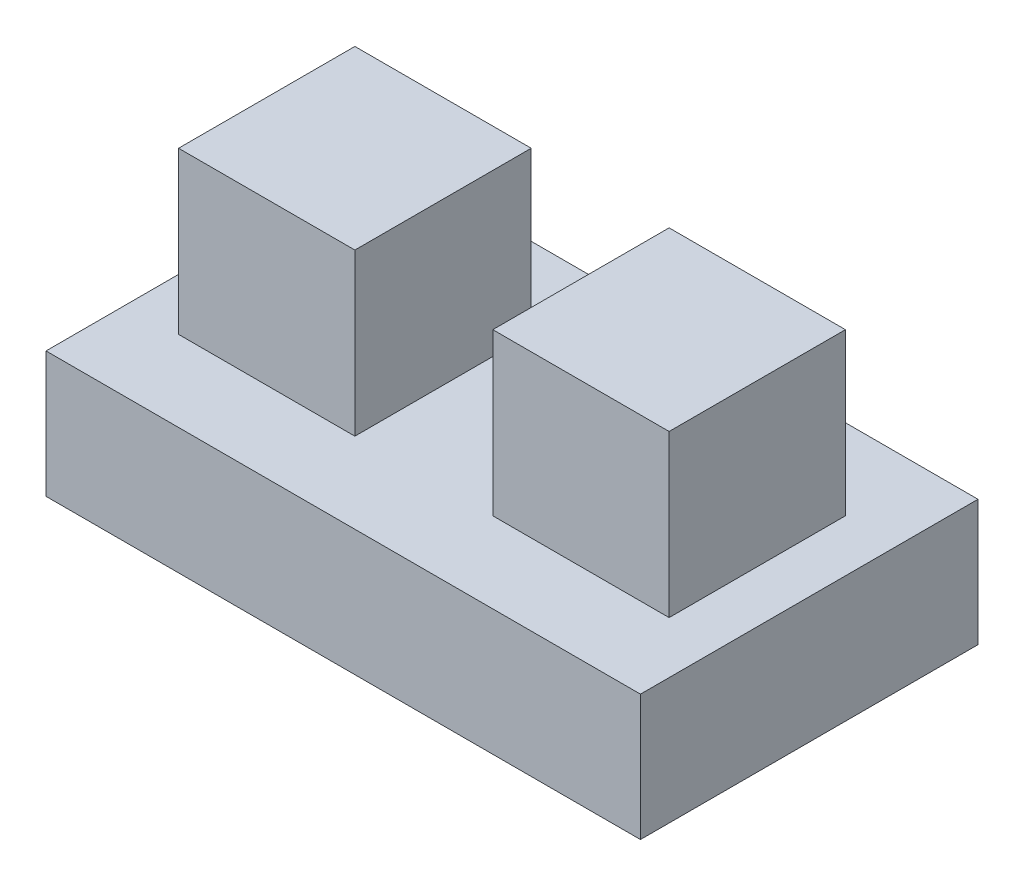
SolidWorks part; units mm, degrees
ref_plane "Ebene vorne" through (0, 0, 0) normal (0, 0, 1) x (1, 0, 0)
ref_plane "Ebene oben" through (0, 0, 0) normal (0, 1, 0) x (1, 0, 0)
ref_plane "Ebene rechts" through (0, 0, 0) normal (1, 0, 0) x (0, 0, -1)
sketch "Skizze1" plane through (0, 0, 0) normal (0, 1, 0) x (1, 0, 0)
  line L0 (-84.5642, 0) -> (115.4627, 0) construction
  line L1 (-59, 33.5) -> (59, 33.5)
  line L2 (-59, 33.5) -> (-59, -33.5)
  line L3 (-59, -33.5) -> (59, -33.5)
  line L4 (59, 33.5) -> (59, -33.5)
  line L5 (0, 70.2533) -> (0, -76.1078) construction
  dimension "D1" = 67
  dimension "D2" = 118
extrude "Aufsatz-Linear austragen1" add sketch "Skizze1" along normal blind 25
sketch "Skizze2" plane through (0, 25, 0) normal (0, 1, 0) x (1, 0, 0)
  line L0 (0, 38.1563) -> (0, -42.2772) construction
  line L1 (-48.6874, 17.5) -> (-13.6874, 17.5)
  line L2 (-48.6874, 17.5) -> (-48.6874, -17.5)
  line L3 (-48.6874, -17.5) -> (-13.6874, -17.5)
  line L4 (-13.6874, 17.5) -> (-13.6874, -17.5)
  line L5 (13.6874, 17.5) -> (48.6874, 17.5)
  line L6 (13.6874, 17.5) -> (13.6874, -17.5)
  line L7 (13.6874, -17.5) -> (48.6874, -17.5)
  line L8 (48.6874, 17.5) -> (48.6874, -17.5)
  line L9 (-66.5446, 0) -> (65.0183, 0) construction
  dimension "D1" = 35
  dimension "D2" = 35
extrude "Aufsatz-Linear austragen2" add sketch "Skizze2" along normal blind 32
